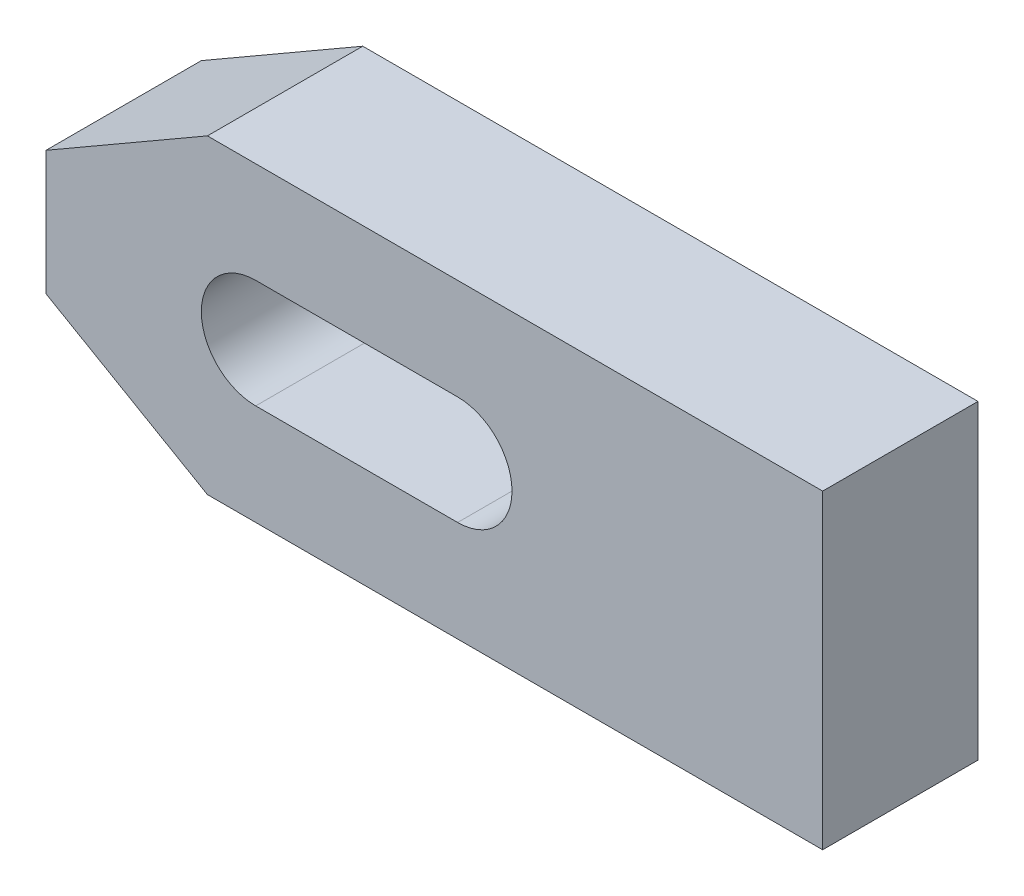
SolidWorks part; units mm, degrees
ref_plane "Plan1" through (0, 0, 0) normal (0, 0, 1) x (1, 0, 0)
ref_plane "Plan2" through (0, 0, 0) normal (0, 1, 0) x (1, 0, 0)
ref_plane "Plan3" through (0, 0, 0) normal (1, 0, 0) x (0, 0, -1)
sketch "Esquisse1" plane through (0, 0, 0) normal (0, 0, 1) x (1, 0, 0)
  line L0 (-16.1077, -10) -> (23.5, -10)
  line L1 (23.5, -10) -> (23.5, 10)
  line L2 (23.5, 10) -> (-16.1077, 10)
  line L3 (-26.5, 4) -> (-26.5, -4)
  line L4 (-16.1077, -10) -> (-26.5, -4)
  line L5 (0, 0) -> (40, 0) construction
  line L6 (-16.1077, 10) -> (-26.5, 4)
  dimension "D1" = 50
  dimension "D2" = 20
  dimension "D3" = 8
  dimension "D4" = 150
  dimension "D5" = 26.5
extrude "Base-Extrusion" add sketch "Esquisse1" along normal blind 10
sketch "Esquisse2" plane through (0, 0, 0) normal (0, 0, 1) x (1, 0, 0)
  line L4 (-26.5, 4) -> (-26.5, -4) construction
  line L5 (-13, 3.5) -> (0, 3.5)
  line L6 (-13, -3.5) -> (0, -3.5)
  arc A0 (-13, -3.5) -> (-13, 3.5) centre (-13, 0) cw
  arc A1 (0, -3.5) -> (0, 3.5) centre (0, 0) ccw
  dimension "D2" = 7
  dimension "D1" = 13
extrude "Enlèv. mat.-Extru.2" cut sketch "Esquisse2" along normal through all
